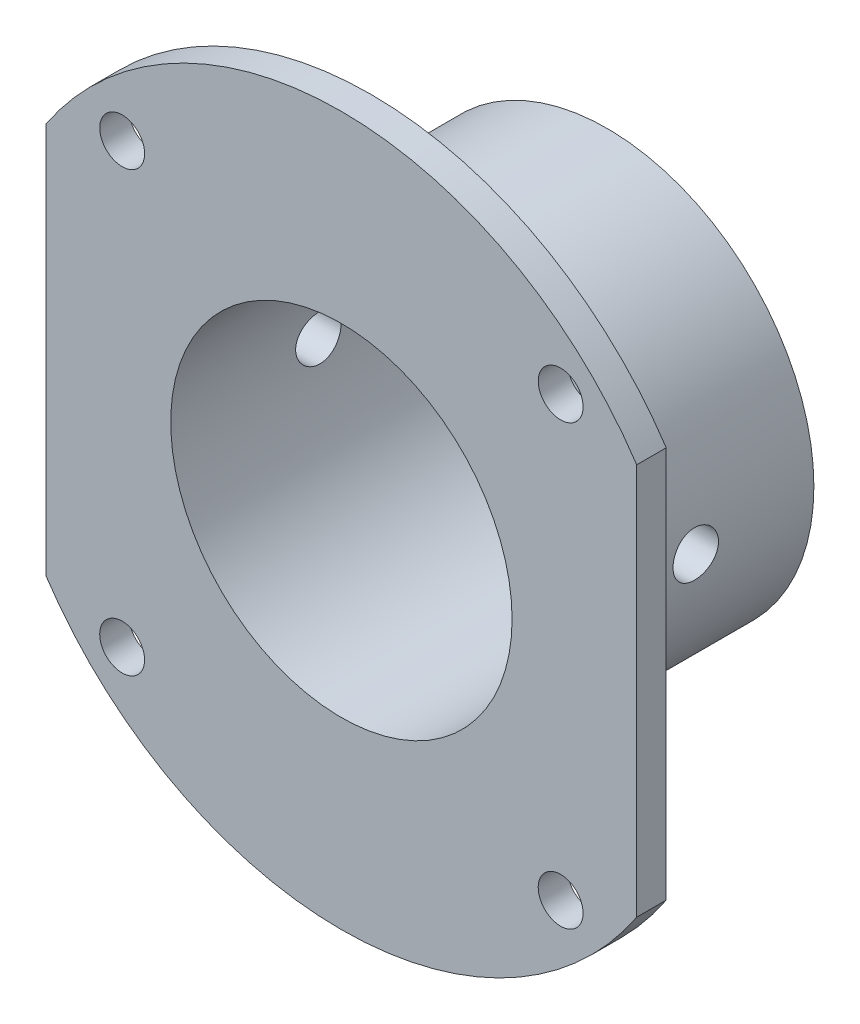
SolidWorks part; units mm, degrees
ref_plane "Front Plane" through (0, 0, 0) normal (0, 0, 1) x (1, 0, 0)
ref_plane "Top Plane" through (0, 0, 0) normal (0, 1, 0) x (1, 0, 0)
ref_plane "Right Plane" through (0, 0, 0) normal (1, 0, 0) x (0, 0, -1)
sketch "Sketch1" plane through (0, 0, 0) normal (0, 0, 1) x (1, 0, 0)
  circle A1 centre (0, 0) radius 44.45
  circle A2 centre (0, 0) radius 36.703
  dimension "D2" = 73.406
  dimension "D3" = 88.9
extrude "Extrude1" add sketch "Sketch1" along normal blind 50.8
sketch "Sketch2" plane through (0, 0, 50.8) normal (0, 0, 1) x (1, 0, 0)
  circle A0 centre (0, 0) radius 76.2
  dimension "D1" = 152.4
extrude "Extrude2" add sketch "Sketch2" along normal blind 6.35
sketch "Sketch3" plane through (0, 0, 57.15) normal (0, 0, 1) x (1, 0, 0)
  circle A0 centre (0, 0) radius 36.703
  dimension "D1" = 73.406
extrude "Cut-Extrude1" cut sketch "Sketch3" against normal through all
sketch "Sketch4" plane through (0, 0, 57.15) normal (0, 0, 1) x (1, 0, 0)
  circle A0 centre (47.1503, 47.1424) radius 4.826
  dimension "D1" = 9.652
  dimension "D3" = 47.1424
  dimension "D2" = 66.675
extrude "Cut-Extrude2" cut sketch "Sketch4" against normal through all
pattern_circular "CirPattern1" count 4 over 360 about axis through (0, 0, 0) along (0, 0, 1) of "Cut-Extrude2"
ref_plane "Plane1" through (44.45, 0, 0) normal (1, 0, 0) x (0, 0, -1)
sketch "Sketch5" plane through (44.45, 0, 0) normal (1, 0, 0) x (0, 0, -1)
  line L0 (-50.8, 0) -> (0, 0) construction
  line L1 (-57.15, 76.2) -> (-57.15, -76.2) construction
  circle A0 centre (-25.4, 0) radius 4.8895
  dimension "D1" = 9.779
  dimension "D2" = 31.75
extrude "Cut-Extrude3" cut sketch "Sketch5" against normal through all
sketch "Sketch7" plane through (0, 0, 57.15) normal (0, 0, 1) x (1, 0, 0)
  line L1 (63.5, 76.2) -> (92.9943, 76.2)
  line L2 (63.5, 76.2) -> (63.5, -76.2)
  line L3 (63.5, -76.2) -> (92.9943, -76.2)
  line L4 (92.9943, 76.2) -> (92.9943, -76.2)
  dimension "D1" = 29.4943
  dimension "D2" = 152.4
  dimension "D3" = 76.2
  dimension "D4" = 63.5
extrude "Cut-Extrude4" cut sketch "Sketch7" against normal through all
mirror "Mirror1" about plane through (0, 0, 0) normal (1, 0, 0) of "Cut-Extrude4"
